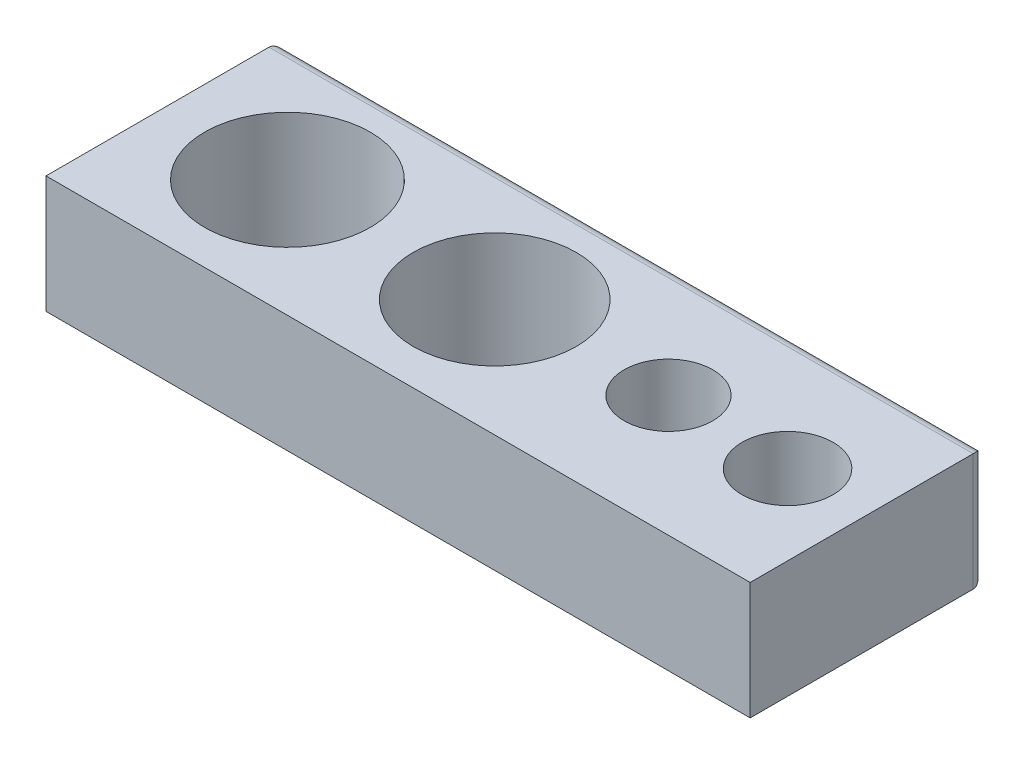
SolidWorks part; units mm, degrees
ref_plane "Front Plane" through (0, 0, 0) normal (0, 0, 1) x (1, 0, 0)
ref_plane "Top Plane" through (0, 0, 0) normal (0, 1, 0) x (1, 0, 0)
ref_plane "Right Plane" through (0, 0, 0) normal (1, 0, 0) x (0, 0, -1)
sketch "Sketch1" plane through (0, 0, 0) normal (0, 1, 0) x (1, 0, 0)
  line L1 (-15, 5) -> (15, 5)
  line L2 (-15, 5) -> (-15, -5)
  line L3 (-15, -5) -> (15, -5)
  line L4 (15, 5) -> (15, -5)
  line L5 (-15, 5) -> (15, -5) construction
  line L6 (-15, -5) -> (15, 5) construction
  point P0 (0, 0)
  dimension "D1" = 10
  dimension "D2" = 30
extrude "Boss-Extrude1" add sketch "Sketch1" along normal blind 5
fillet "Fillet1" radius 0.5 4 edges at (15, 2.5, -5) (0, 5, -5) (-15, 2.5, -5) (0, 0, -5)
sketch "Sketch2" plane through (0, 0, 0) normal (0, -1, 0) x (1, 0, 0)
  circle A0 centre (-0.8827, 0) radius 3.475
  circle A1 centre (6.3541, -0.165) radius 1.8875
  circle A2 centre (-9.713, 0) radius 3.525
  circle A3 centre (11.5936, 0) radius 1.9375
  dimension "D1" = 6.95
  dimension "D2" = 3.775
  dimension "D3" = 7.05
  dimension "D4" = 3.875
extrude "Cut-Extrude1" cut sketch "Sketch2" against normal blind 5
